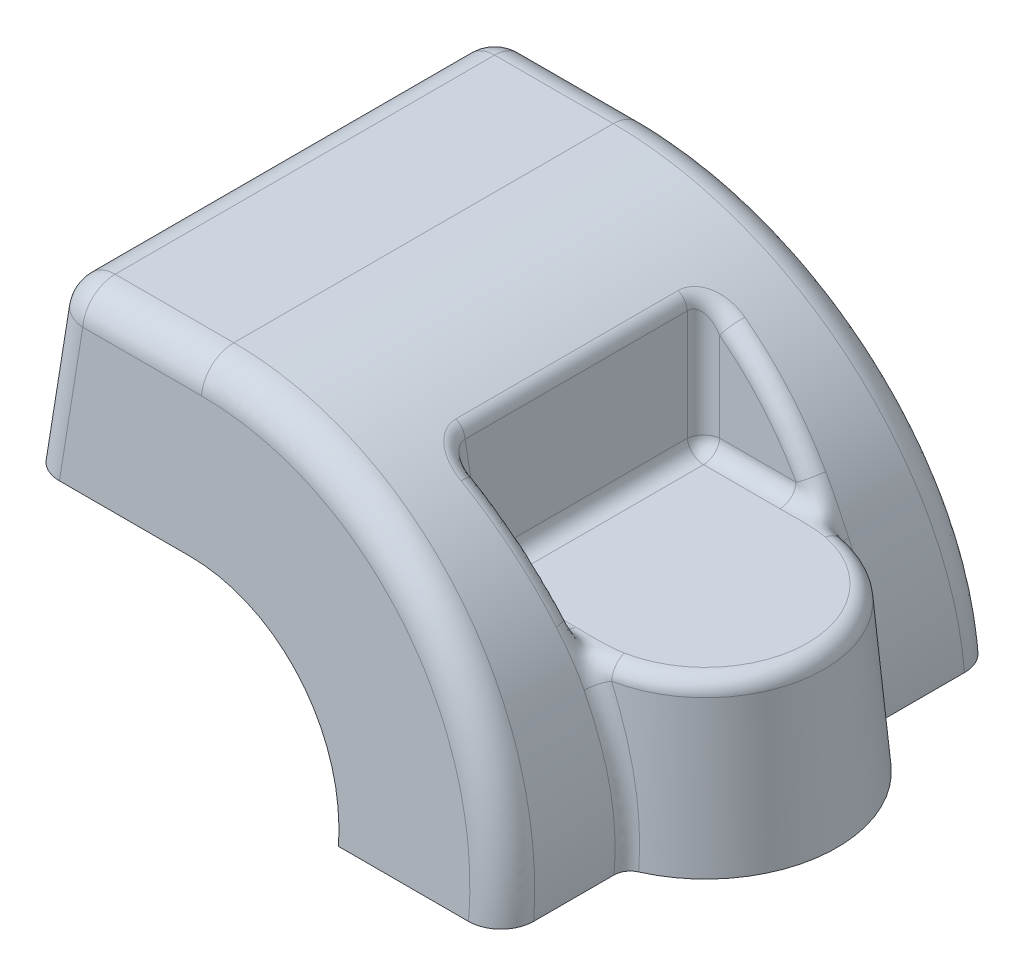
SolidWorks part; units mm, degrees
ref_plane "Front Plane" through (0, 0, 0) normal (0, 0, 1) x (1, 0, 0)
ref_plane "Top Plane" through (0, 0, 0) normal (0, 1, 0) x (1, 0, 0)
ref_plane "Right Plane" through (0, 0, 0) normal (1, 0, 0) x (0, 0, -1)
sketch "Sketch1" plane through (0, 0, 0) normal (0, 0, 1) x (1, 0, 0)
  line L0 (-25, 25) -> (0, 25)
  line L1 (25, 0) -> (50, 0)
  line L2 (0, 50) -> (-25, 50)
  line L3 (-25, 50) -> (-25, 25)
  arc A0 (0, 25) -> (25, 0) centre (0, 0) cw
  arc A1 (50, 0) -> (0, 50) centre (0, 0) ccw
  dimension "D1" = 25
  dimension "D2" = 50
  dimension "D3" = 25
extrude "Extrude1" add sketch "Sketch1" along normal mid plane 76.2
draft "Draft1" type of draft neutral plane draft angle 5 neutral plane "Top Plane" faces to draft 2 parameters "D1"=5
draft "Draft2" type of draft neutral plane draft angle 5 faces to draft 1 parameters "D1"=5
fillet "Fillet1" radius 5 7 edges at (-11.4064, 50, -33.7256) (-11.4064, 50, 33.7256) (-23.9064, 37.5, -34.8192) (-23.9064, 37.5, 34.8192) (-22.8128, 50, 0) (35.3553, 35.3553, -35.0068) (35.3553, 35.3553, 35.0068)
sketch "Sketch2" plane through (0, 25, 0) normal (0, -1, 0) x (1, 0, 0)
  line L0 (0, 0) -> (59.5, 0) construction
  line L1 (25, 18) -> (59.5, 18)
  line L2 (25, 18) -> (25, -18)
  line L3 (25, -18) -> (59.5, -18)
  line L4 (59.5, 18) -> (59.5, -18)
  line L5 (50, 33.0809) -> (50, -33.0809) construction
  line L6 (25, 38.1) -> (25, -38.1) construction
  dimension "D1" = 36
  dimension "D2" = 9.5
extrude "Pocket" cut sketch "Sketch2" against normal through all draft 5
sketch "Sketch3" plane through (0, 25, 0) normal (0, 1, 0) x (1, 0, 0)
  line L0 (25, 18) -> (43.3013, 18) construction
  line L1 (43.3013, 18) -> (43.3013, -18)
  arc A0 (43.3013, 18) -> (43.3013, -18) centre (43.3013, 0) cw
extrude "Boss" add sketch "Sketch3" against normal through all draft 5
fillet "Fillet2" radius 2.5 7 edges at (24.1588, 34.615, 18.8412) (24.1588, 34.615, -18.8412) (34.1506, 25, 18) (25, 25, 0) (34.1506, 25, -18) (47.4396, 15.795, 18.3443) (48.9314, 10.2819, -18.4476)
fillet "Fillet3" radius 2.5 12 edges at (48.5935, 25.4653, 17.1618) (44.167, 26.4502, 17.9781) (39.7745, 30.8691, 18.5135) (24.1255, 43.7945, 18.9566) (24.2068, 43.7497, -19.0234) (39.707, 30.938, -18.5195) (44.0862, 26.4927, -17.9973) (49.9854, 25.2021, -16.6939) (23.3176, 44.23, 0) (31.3796, 38.9271, 19.2185) (31.3796, 38.9271, -19.2185) (61.3013, 25, 0)
other "DeleteFace1"
sketch3d "3DSketch1"
  line L0 (45.274, 25, -15.7092) -> (27.2908, 25, -15.7092) construction
  line L1 (45.274, 25, -15.7092) -> (39.0356, 25, -15.7092)
  spline S0 degree 3 poles (39.0356, 27.2821, -18.1997) (39.0356, 25.9222, -18.0807) (39.0356, 25, -17.0742) (39.0356, 25, -15.7092) knots 0 0 0 0 1 1 1 1 weights 1 0.824852 0.824852 1 construction
  spline S1 degree 3 poles (39.0356, 27.2821, -18.1997) (39.0356, 25.9222, -18.0807) (39.0356, 25, -17.0742) (39.0356, 25, -15.7092) knots 0 0 0 0 1 1 1 1 weights 1 0.824852 0.824852 1
surface "Surface-Trim1"
surface "Surface-Offset1" parameters "D1"=0
sketch3d "3DSketch2"
  spline S0 degree 3 poles (-1475.1063, -721.3805, -1076.6794) (125.577, 60.577, -107.9755) (56.946, 27.702, -10.7469) (45.8287, 22.267, -18.3314) (45.6345, 22.1717, -18.5211) (45.3142, 22.0141, -18.9619) (45.1883, 21.9518, -19.2129) (40.8557, 19.7833, -32.8946) (140.7424, 68.0405, -87.102) (656.1374, 327.4898, 1856.9034) knots -12.294789 -12.294789 -12.294789 -12.294789 0.25 0.25 0.5 0.5 0.75 0.75 13.294825 13.294825 13.294825 13.294825 only from (46.7527, 22.7179, -17.8694) to (44.9762, 21.8436, -20.3147) construction
  spline S1 degree 3 poles (46.7527, 22.7179, -17.8694) (46.5033, 22.5965, -17.9284) (46.2631, 22.4793, -18.035) (45.8287, 22.267, -18.3314) (45.6345, 22.1717, -18.5211) (45.3142, 22.0141, -18.9619) (45.1883, 21.9518, -19.2129) (45.019, 21.867, -19.7476) (44.9757, 21.8447, -20.0311) (44.9762, 21.8436, -20.3147) knots 0 0 0 0 0.25 0.25 0.5 0.5 0.75 0.75 1 1 1 1
surface "Surface-Trim2"
other "DeleteFace2"
surface "Surface-Knit1"
sketch3d "3DSketch3"
  point P0 (41.0901, 28.4887, -20.6901)
  point P1 (44.9762, 21.8436, -20.3147)
  point P8 (27.5703, 41.7118, -21.7892)
  point P9 (41.0901, 28.4887, -20.6901)
  point P10 (44.9762, 21.8436, -20.3147)
  point P11 (50, 0, -20.7491)
surface "Surface-Trim3"
sketch "Sketch4" plane through (0, 25, 0) normal (0, 1, 0) x (1, 0, 0)
  line L4 (27.2908, -15.7092) -> (45.274, -15.7092)
  line L5 (45.274, 15.7092) -> (39.0356, 15.7092)
  line L6 (39.0356, 15.7092) -> (27.2908, 15.7092)
  line L7 (27.2908, 15.7092) -> (27.2908, -15.7092)
  line L8 (27.2908, -15.7092) -> (45.274, -15.7092)
  line L10 (39.0356, 15.7092) -> (27.2908, 15.7092)
  line L11 (27.2908, 15.7092) -> (27.2908, -15.7092)
  arc A1 (46.2804, -15.4241) -> (46.2804, 15.4241) centre (43.3013, 0) ccw
  arc A2 (46.2804, -15.4241) -> (46.2804, 15.4241) centre (43.3013, 0) ccw
  spline S0 degree 3 poles (39.0356, 15.7092) (41.4524, 15.7092) (43.9038, 15.8831) (46.2804, 15.4241) knots 0 0 0 0 1 1 1 1
  spline S2 degree 3 poles (729.6698, -2935.1806) (-1007.0874, 3659.6333) (1301.0649, -4025.2254) (-534.2835, 2917.6431) knots -131.156451 -131.156451 -131.156451 -131.156451 231.209345 231.209345 231.209345 231.209345 only from (45.274, -15.7092) to (46.2804, -15.4241)
  spline S3 degree 3 poles (-33.7254, -981.3701) (673.6566, 1861.6155) (-369.6166, -1475.7059) (233.1299, 997.8869) knots -186.132389 -186.132389 -186.132389 -186.132389 84.117379 84.117379 84.117379 84.117379 only from (46.2804, 15.4241) to (45.274, 15.7092)
  spline S4 degree 3 poles (45.274, -15.7092) (45.6013, -15.5853) (45.9368, -15.4905) (46.2804, -15.4241) knots 0 0 0 0 1 1 1 1
  dimension "D1" = 0
other "DeleteFace3"
surface "Surface-Plane1" sketch "Sketch4"
surface "Surface-Fill1"
other "SurfaceCut1"
mirror "Mirror1" about plane through (0, 0, 0) normal (0, 0, 1)
